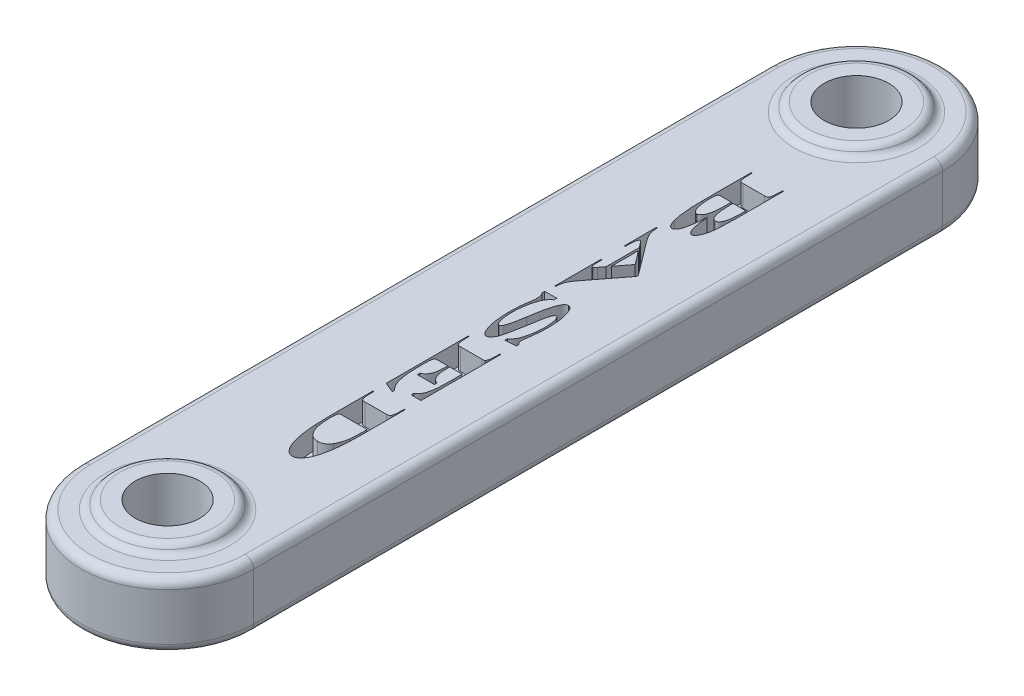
SolidWorks part; units mm, degrees
ref_plane "Front Plane" through (0, 0, 0) normal (0, 0, 1) x (1, 0, 0)
ref_plane "Top Plane" through (0, 0, 0) normal (0, 1, 0) x (1, 0, 0)
ref_plane "Right Plane" through (0, 0, 0) normal (1, 0, 0) x (0, 0, -1)
sketch "Sketch2" plane through (0, 0, 0) normal (0, 1, 0) x (-1, 0, 0)
  line L0 (0, 0) -> (100, 0) construction
  line L1 (0, 0) -> (0, -117.3978) construction
  line L2 (0, 80) -> (0, -80) construction
  line L3 (20, 80) -> (20, -80)
  line L4 (-20, 80) -> (-20, -80)
  line L6 (133.8609, 17.5) -> (145, 17.5)
  line L8 (133.8609, -17.5) -> (145, -17.5)
  line L9 (145, 17.5) -> (145, -17.5)
  line L10 (135, 0) -> (145, -17.5) construction
  line L11 (135, 0) -> (145, 17.5) construction
  line L12 (-145, 17.5) -> (-133.8609, 17.5)
  line L13 (-145, 17.5) -> (-145, -17.5)
  line L14 (-145, -17.5) -> (-133.8609, -17.5)
  line L16 (-145, 17.5) -> (-135, 0) construction
  line L17 (-145, -17.5) -> (-135, 0) construction
  arc A0 (65.9983, -75.128) -> (65.9983, 75.128) centre (0, 0) ccw construction
  arc A1 (79.198, -90.1536) -> (79.198, 90.1536) centre (0, 0) ccw
  arc A2 (52.7987, -60.1024) -> (52.7987, 60.1024) centre (0, 0) ccw
  arc A3 (52.7987, -60.1024) -> (79.198, -90.1536) centre (65.9983, -75.128) ccw
  arc A4 (79.198, 90.1536) -> (52.7987, 60.1024) centre (65.9983, 75.128) ccw
  arc A5 (-65.9983, -75.128) -> (-65.9983, 75.128) centre (0, 0) cw construction
  arc A6 (-79.198, -90.1536) -> (-79.198, 90.1536) centre (0, 0) cw
  arc A7 (-52.7987, -60.1024) -> (-52.7987, 60.1024) centre (0, 0) cw
  arc A8 (-52.7987, -60.1024) -> (-79.198, -90.1536) centre (-65.9983, -75.128) cw
  arc A9 (-79.198, 90.1536) -> (-52.7987, 60.1024) centre (-65.9983, 75.128) cw
  arc A10 (20, 80) -> (-20, 80) centre (0, 80) ccw
  arc A11 (-20, -80) -> (20, -80) centre (0, -80) ccw
  circle A12 centre (65.9983, 75.128) radius 7.5
  circle A13 centre (65.9983, -75.128) radius 7.5
  circle A14 centre (0, -80) radius 7.5
  circle A15 centre (0, 80) radius 7.5
  circle A16 centre (-65.9983, 75.128) radius 7.5
  circle A17 centre (-65.9983, -75.128) radius 7.5
  circle A18 centre (0, 0) radius 135
  point P4 (100, 0)
  point P14 (-100, 0)
  point P21 (0, 0)
  point P39 (135, 0)
  point P44 (-135, 0)
  dimension "D1" = 15
  dimension "D2" = 12.5
  dimension "D3" = 12.5
  dimension "D4" = 270
  dimension "D9" = 170
  dimension "D5" = 10
  dimension "D6" = 10
  dimension "D7" = 35
  dimension "D8" = 100
  dimension "D10" = 160
extrude "Extrude1" add sketch "Sketch2" along normal blind 15 contours L4 A11 L3 A10 A15 A14
sketch "Sketch3" plane through (0, 15, 0) normal (0, 1, 0) x (1, 0, 0)
  text T0 "BASED" font "Times New Roman" height 7.5
extrude "Extrude2" cut sketch "Sketch3" against normal blind 5
fillet "Fillet1" radius 2 6 edges at (0, 15, 100) (20, 15, 0) (0, 15, -100) (0, 0, 87.5) (0, 0, -72.5) (-20, 15, 0)
sketch "Sketch4" plane through (0, 15, 0) normal (0, 1, 0) x (1, 0, 0)
  circle A2 centre (0, 80) radius 12.5
  circle A3 centre (0, 80) radius 12.5
  circle A4 centre (0, -80) radius 7.5 construction
  circle A5 centre (0, -80) radius 12.5
  circle A6 centre (0, -80) radius 12.5
  circle A7 centre (0, 80) radius 7.5 construction
  circle A8 centre (0, -80) radius 7.5
  circle A9 centre (0, 80) radius 7.5
  dimension "D1" = 5
  dimension "D2" = 5
extrude "Extrude3" add sketch "Sketch4" along normal blind 2
fillet "Fillet2" radius 2 2 edges at (0, 15, 92.5) (0, 15, -67.5)
fillet "Fillet3" radius 2 2 edges at (0, 17, 92.5) (0, 17, -67.5)
fillet "Fillet4" radius 2 4 edges at (0, 0, 100) (20, 0, 0) (0, 0, -100) (-20, 0, 0)
